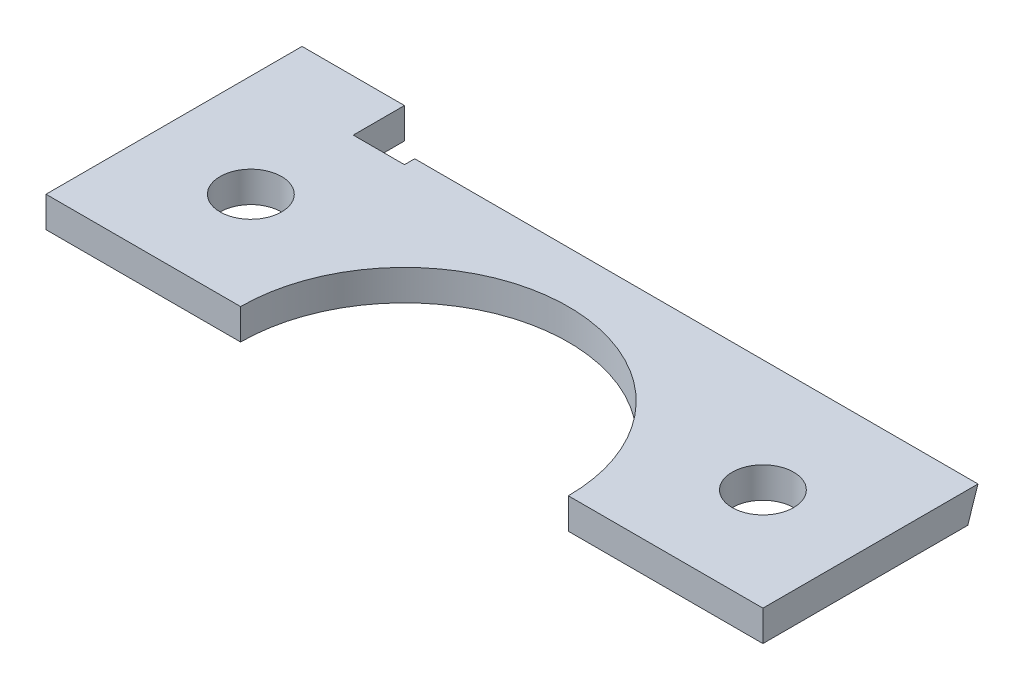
SolidWorks part; units mm, degrees
ref_plane "Front" through (0, 0, 0) normal (0, 0, 1) x (1, 0, 0)
ref_plane "Top" through (0, 0, 0) normal (0, 1, 0) x (1, 0, 0)
ref_plane "Right" through (0, 0, 0) normal (1, 0, 0) x (0, 0, -1)
sketch "Sketch1" plane through (0, 0, 0) normal (0, 1, 0) x (1, 0, 0)
  line L0 (10, 20) -> (10, 25)
  line L1 (0, 0) -> (19, 0)
  line L2 (0, 0) -> (0, 25)
  line L3 (0, 25) -> (10, 25)
  line L4 (70, 0) -> (70, 21)
  line L5 (15, 20) -> (15, 21)
  line L6 (10, 20) -> (15, 20)
  line L7 (15, 21) -> (70, 21)
  line L8 (0, 20) -> (70, 20) construction
  line L9 (10, 0) -> (10, 25) construction
  line L10 (15, 0) -> (15, 25) construction
  line L11 (51, 0) -> (70, 0)
  line L12 (0, 0) -> (70, 0) construction
  circle A0 centre (10, 10) radius 3
  circle A1 centre (60, 10) radius 3
  arc A2 (51, 0) -> (19, 0) centre (35, 0) ccw
extrude "Extrude1" add sketch "Sketch1" along normal blind 3
sketch "Sketch2" plane through (70, 0, 0) normal (1, 0, 0) x (0, 0, -1)
  line L0 (21, 3) -> (21, 0)
  line L2 (21, 0) -> (20, 0)
  line L3 (0, 0) -> (21, 0) construction
  line L4 (20, 0) -> (21, 3)
extrude "Cut-Extrude1" cut sketch "Sketch2" against normal blind 55
